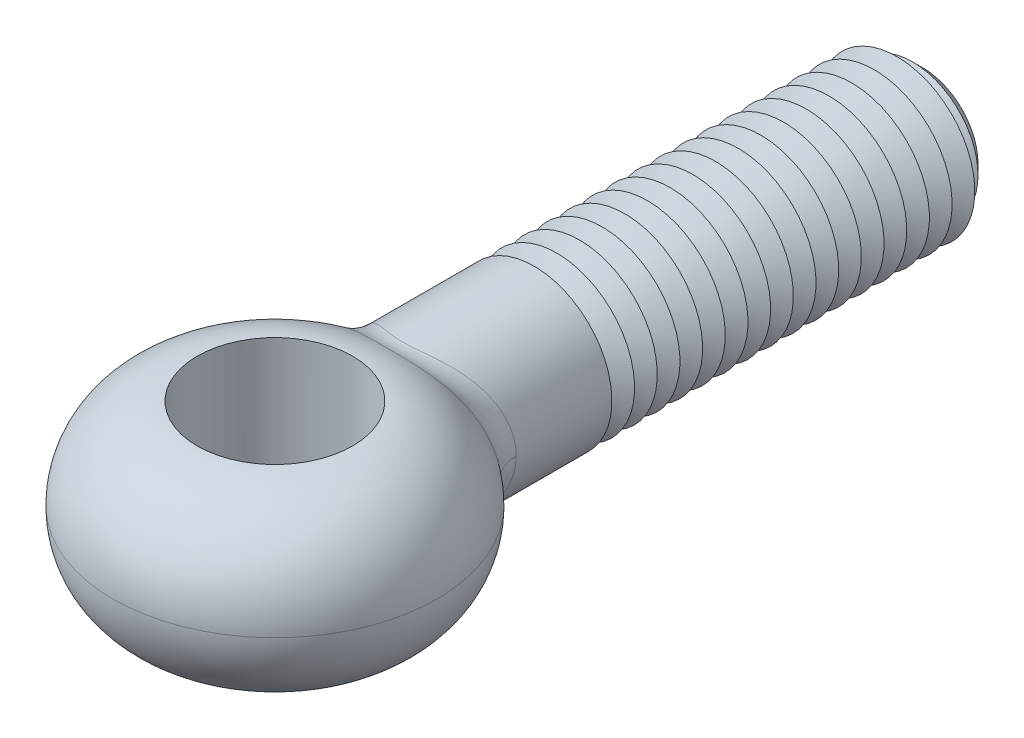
SolidWorks part; units mm, degrees
ref_plane "Front Plane" through (0, 0, 0) normal (0, 0, 1) x (1, 0, 0)
ref_plane "Top Plane" through (0, 0, 0) normal (0, 1, 0) x (1, 0, 0)
ref_plane "Right Plane" through (0, 0, 0) normal (1, 0, 0) x (0, 0, -1)
sketch "Sketch7" plane through (0, 0, 0) normal (0, 1, 0) x (1, 0, 0)
  circle A0 centre (0, 0) radius 12.5
  dimension "D1" = 25
extrude "Boss-Extrude3" add sketch "Sketch7" along normal mid plane 14
sketch "Sketch8" plane through (0, 0, 0) normal (0, 0, 1) x (1, 0, 0)
  circle A0 centre (0, 0) radius 6
  dimension "D1" = 12
extrude "Boss-Extrude4" add sketch "Sketch8" against normal blind 50
fillet "Fillet5" radius 7 2 edges at (0, -7, 12.5) (0, 7, 12.5)
fillet "Fillet6" radius 3 2 edges at (0.1735, -5.9975, -9.1081) (-0.1735, 5.9975, -9.1081)
chamfer "Chamfer1" distance 1.75 angle 45 1 edges at (6, 0, -50)
sketch "Sketch10" plane through (0, 0, 0) normal (0, 1, 0) x (1, 0, 0)
  line L0 (0, 28.1405) -> (0, -7.9233) construction
sketch "Sketch11" plane through (0, 0, 0) normal (0, 1, 0) x (1, 0, 0)
  line L0 (-6, 20) -> (-4.4845, 20.875)
  line L1 (-6, 48.25) -> (-6, 12.6194) construction
  line L2 (-4.4845, 20.875) -> (-6, 21.75)
  line L3 (-6, 21.75) -> (-6, 20)
  line L4 (4.25, 50) -> (-4.25, 50) construction
  dimension "D1" = 1.75
  dimension "D2" = 30
revolve "Cut-Revolve1" cut sketch "Sketch11" angle 360 about L0
pattern_linear "LPattern1" count 17 spacing 1.75 along (0, 0, -1) of "Cut-Revolve1"
sketch "Sketch12" plane through (0, 0, 0) normal (0, 1, 0) x (1, 0, 0)
  circle A0 centre (0, 0) radius 6
  dimension "D1" = 12
extrude "Cut-Extrude1" cut sketch "Sketch12" against normal mid plane 14
